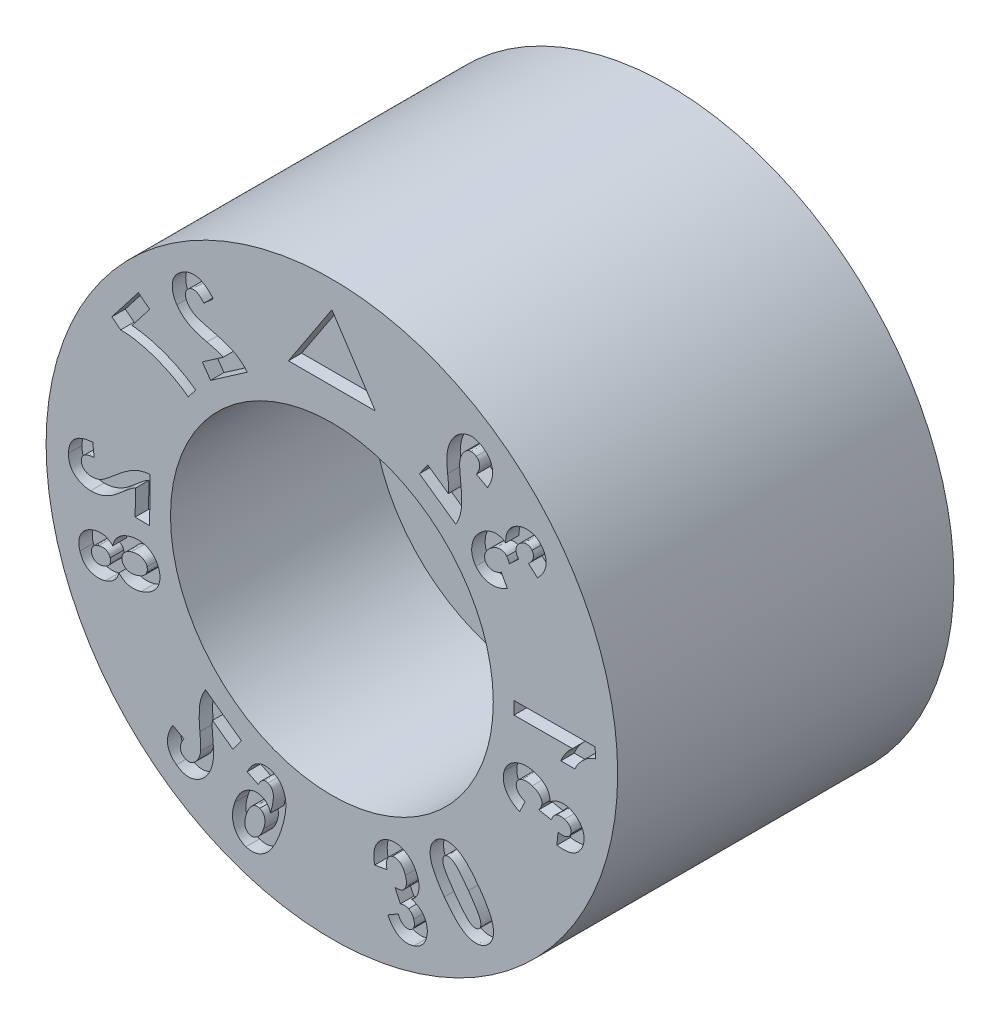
SolidWorks part; units mm, degrees
ref_plane "Front Plane" through (0, 0, 0) normal (0, 0, 1) x (1, 0, 0)
ref_plane "Top Plane" through (0, 0, 0) normal (0, 1, 0) x (1, 0, 0)
ref_plane "Right Plane" through (0, 0, 0) normal (1, 0, 0) x (0, 0, -1)
imported_body "Imported1"
other "Move Face1" parameters "D1"=0.18
other "DeleteFace1"
sketch "Sketch1" plane through (0, 0, 0) normal (0, 0, 1) x (1, 0, 0)
  arc A1 (-1.2291, 2.4419) -> (0, 2.7338) centre (0, 0) ccw construction
  text T0 "27  28  29  30  31  32" font "Arial Narrow" height 1.2
extrude "Cut-Extrude1" cut sketch "Sketch1" against normal blind 0.2
